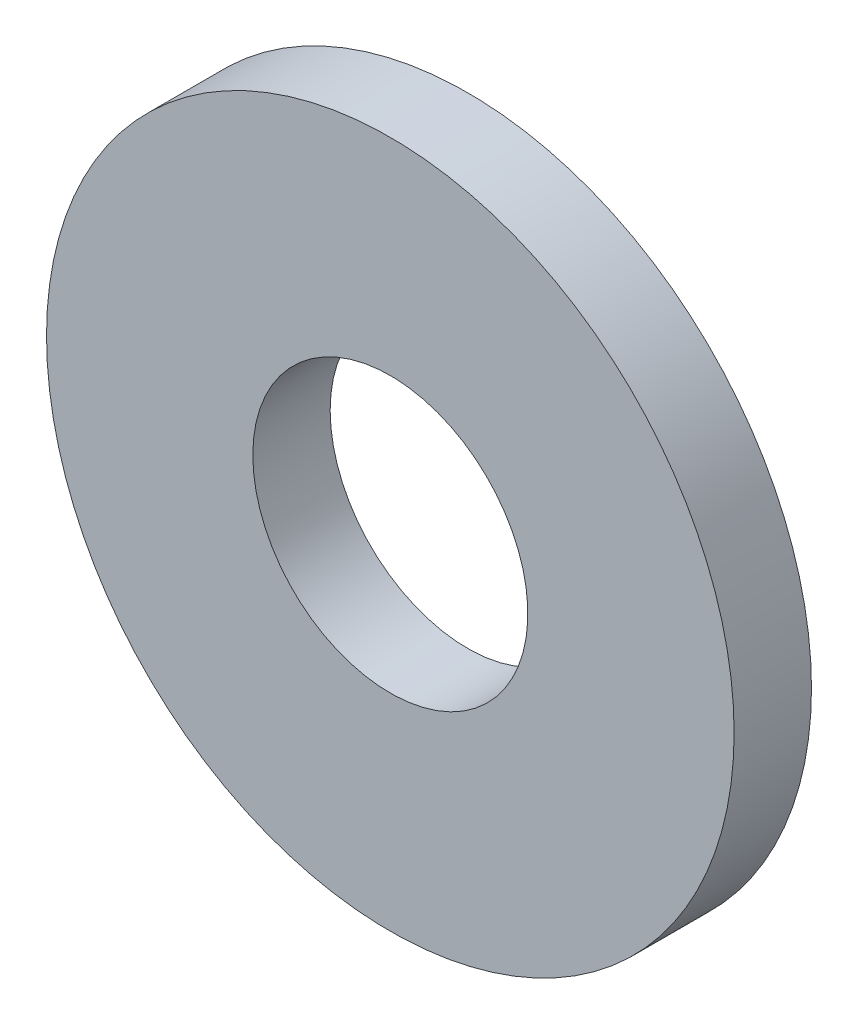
SolidWorks part; units mm, degrees
ref_plane "Plan1" through (0, 0, 0) normal (0, 0, 1) x (1, 0, 0)
ref_plane "Plan2" through (0, 0, 0) normal (0, 1, 0) x (1, 0, 0)
ref_plane "Plan3" through (0, 0, 0) normal (1, 0, 0) x (0, 0, -1)
sketch "E_corps" plane through (0, 0, 0) normal (0, 0, 1) x (1, 0, 0)
  circle A0 centre (0, 0) radius 20
  dimension "Diam_base" = 40
extrude "Corps" add sketch "E_corps" along normal blind 4.5
sketch "E_perçage" plane through (0, 0, 0) normal (0, 0, -1) x (-1, 0, 0)
  circle A0 centre (0, 0) radius 8
  dimension "Diamètre_nominal" = 16
extrude "Diamètre_nominal" cut sketch "E_perçage" against normal through all
